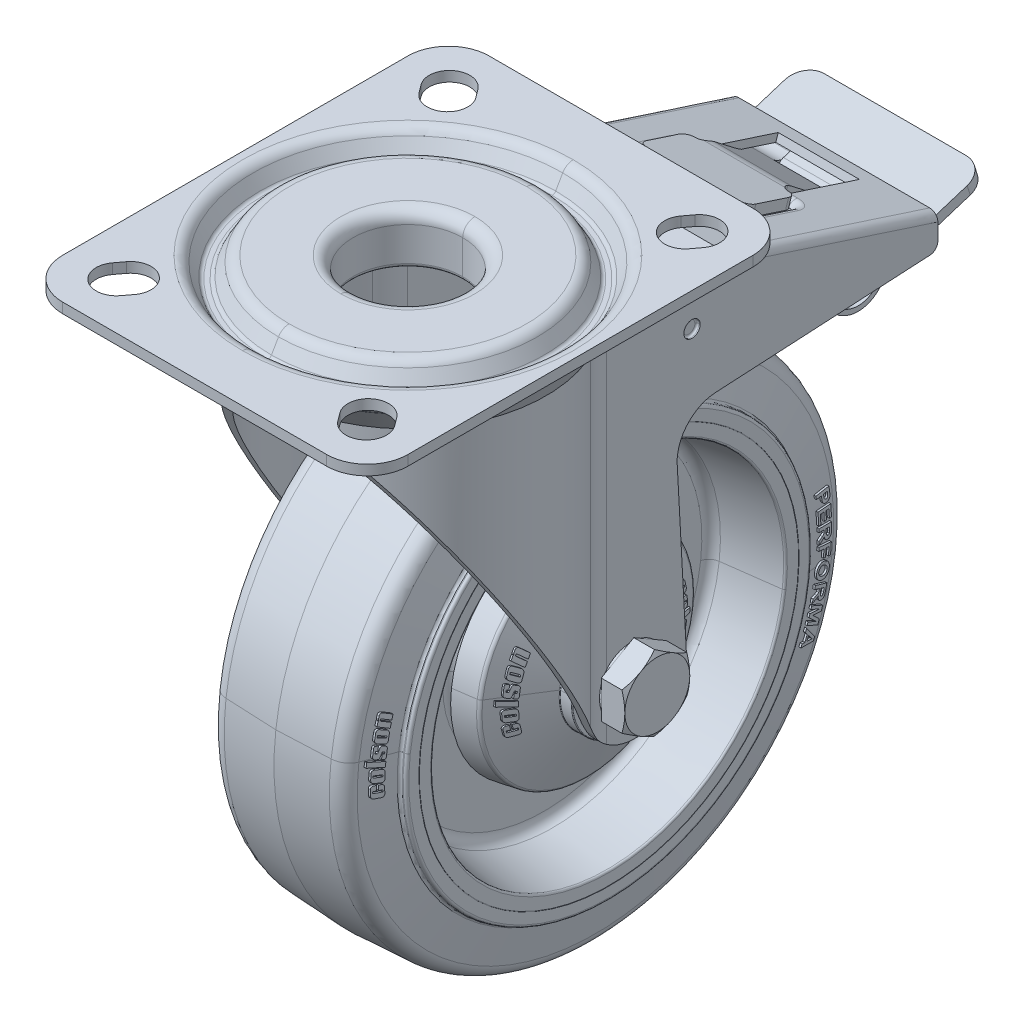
SolidWorks part; units mm, degrees
ref_plane "Front Plane" through (0, 0, 0) normal (0, 0, 1) x (1, 0, 0)
ref_plane "Top Plane" through (0, 0, 0) normal (0, 1, 0) x (1, 0, 0)
ref_plane "Right Plane" through (0, 0, 0) normal (1, 0, 0) x (0, 0, -1)
imported_body "1.5030 Pyörä D125 H155 kääntyvä lukollinen kuulalaakerilla.STEP<1>"
sketch "Sketch1" plane through (-29.6876, 0, 0) normal (1, 0, 0) x (0, 0, -1)
  line L1 (-162.5782, 49.1883) -> (-148.275, 49.1883)
  line L2 (-162.5782, 49.1883) -> (-162.5782, 44.8227)
  line L3 (-162.5782, 44.8227) -> (-148.275, 44.8227)
  line L4 (-148.275, 49.1883) -> (-148.275, 44.8227)
extrude "Boss-Extrude1" add sketch "Sketch1" against normal up to surface (0.2 mm away)
